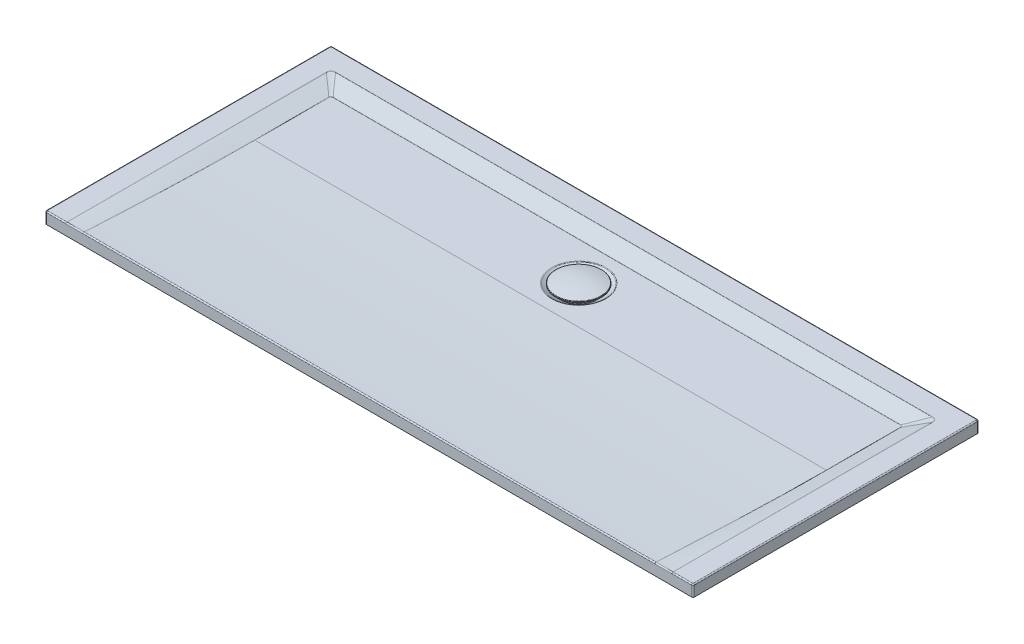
SolidWorks part; units mm, degrees
ref_plane "Płaszczyzna przednia" through (0, 0, 0) normal (0, 0, 1) x (1, 0, 0)
ref_plane "Płaszczyzna górna" through (0, 0, 0) normal (0, 1, 0) x (1, 0, 0)
ref_plane "Płaszczyzna prawa" through (0, 0, 0) normal (1, 0, 0) x (0, 0, -1)
sketch "Szkic1" plane through (0, 0, 0) normal (0, 1, 0) x (1, 0, 0)
  line L0 (0, 375) -> (0, -375) construction
  line L1 (-850, 375) -> (850, 375)
  line L2 (-850, 375) -> (-850, -375)
  line L3 (-850, -375) -> (850, -375)
  line L4 (850, 375) -> (850, -375)
  line L5 (-795, -375) -> (-795, 320)
  line L6 (-795, 320) -> (795, 320)
  line L7 (795, 320) -> (795, -375)
  line L8 (-750, -375) -> (-750, 275)
  line L9 (-750, 275) -> (750, 275)
  line L10 (750, 275) -> (750, -375)
  circle A0 centre (0, 175) radius 45
  circle A1 centre (0, 175) radius 70
  point P9 (0, 320)
  dimension "D6" = 90
  dimension "D7" = 140
  dimension "D1" = 1700
  dimension "D2" = 55
  dimension "D3" = 55
  dimension "D5" = 200
  dimension "D8" = 750
  dimension "D4" = 45
sketch "Szkic2" plane through (0, 0, 0) normal (0, 1, 0) x (1, 0, 0)
  line L0 (-850, -375) -> (850, -375) construction
  line L1 (850, 375) -> (850, -375) construction
  line L2 (795, 320) -> (795, -375) construction
  line L3 (-795, 320) -> (795, 320) construction
  line L4 (-850, 375) -> (850, 375) construction
  line L5 (-795, -375) -> (-795, 320) construction
  line L6 (-850, 375) -> (-850, -375) construction
  line L7 (-850, -375) -> (-795, -375)
  line L8 (850, 375) -> (850, -375)
  line L9 (795, 320) -> (795, -375)
  line L10 (-795, 320) -> (795, 320)
  line L11 (-850, 375) -> (850, 375)
  line L12 (-795, -375) -> (-795, 320)
  line L13 (-850, 375) -> (-850, -375)
  line L14 (795, -375) -> (850, -375)
surface "Powierzchnia-Płaszczyzna1" sketch "Szkic2"
ref_plane "Płaszczyzna1" through (0, -15, 0) normal (0, 1, 0) x (-1, 0, 0)
sketch "Szkic3" plane through (0, -15, 0) normal (0, 1, 0) x (-1, 0, 0)
  line L0 (750, -75) -> (-750, -75)
  line L1 (750, 375) -> (750, -275) construction
  line L2 (-750, -275) -> (-750, 375) construction
  line L3 (0, -75) -> (0, -275) construction
  line L4 (750, -275) -> (-750, -275) construction
  line L5 (-750, -275) -> (-750, -75)
  line L6 (750, -75) -> (750, -275)
  line L7 (750, -275) -> (-750, -275)
  circle A0 centre (0, -175) radius 70 construction
  circle A1 centre (0, -175) radius 70
  point P10 (0, -175)
surface "Powierzchnia-Płaszczyzna2" sketch "Szkic3"
sketch "Szkic4" plane through (0, 0, 0) normal (0, 1, 0) x (1, 0, 0)
  line L0 (750, -375) -> (-750, -375)
other "Granica-Powierzchnia1"
other "Granica-Powierzchnia2"
other "Granica-Powierzchnia3"
mirror "Lustro1" about plane through (0, 0, 0) normal (1, 0, 0)
sketch "Szkic5" plane through (0, 0, 0) normal (0, 1, 0) x (1, 0, 0)
  line L0 (850, 375) -> (850, -375) construction
  line L1 (-850, 375) -> (850, 375) construction
  line L2 (-850, 375) -> (-850, -375) construction
  line L3 (-850, -375) -> (850, -375) construction
  line L4 (850, 375) -> (850, -375)
  line L5 (-850, 375) -> (850, 375)
  line L6 (-850, 375) -> (-850, -375)
  line L7 (-850, -375) -> (850, -375)
surface "Powierzchnia-Wyciągnięcie1" sketch "Szkic5" parameters "D1"=30
sketch "Szkic7" plane through (0, 0, 0) normal (1, 0, 0) x (0, 0, -1)
  line L0 (175, 0) -> (175, -30) construction
  line L1 (375, -30) -> (-375, -30) construction
  line L2 (220, -30) -> (220, -28)
  line L3 (220, -28) -> (224, -28)
  line L6 (224, -28) -> (245, -15)
  dimension "D1" = 90
  dimension "D2" = 2
  dimension "D3" = 98
surface "Powierzchnia-Obrót wokół linii środkowej1" sketch "Szkic7" parameters "D1"=360
surface "Powierzchnia-Płaszczyzna3"
surface "Powierzchnia-Połącz1"
fillet "Zaokrąglenie1" radius 4 6 edges at (0, -28, -224) (0, -15, -105) (850, -15, 375) (850, -15, -375) (-850, -15, -375) (-850, -15, 375)
fillet "Zmienne zaokrąglenie1" radius 40 2 edges at (772.5, -7.5, -297.5)
fillet "Zaokrąglenie3" radius 3 12 edges
fillet "Zaokrąglenie4" radius 3 12 edges at (-848.8284, 0, -373.8284) (0, 0, -375) (848.8284, 0, -373.8284) (850, 0, 0) (848.8284, 0, 373.8284) (820.5, 0, 375) (-820.5, 0, 375) (-848.8284, 0, 373.8284) (-850, 0, 0)
sketch "Szkic8" plane through (0, 0, 0) normal (1, 0, 0) x (0, 0, -1)
  line L0 (175, 0) -> (175, -30) construction
  line L1 (175, -5.6601) -> (179.8469, -5.6601) construction
  line L2 (235, -14.7573) -> (235, -17)
  line L3 (235, -17) -> (175, -17)
  line L4 (175, -17) -> (175, -5.6601)
  line L5 (175, -5.6601) -> (199.9922, 95.6514)
  arc A0 (175, -5.6601) -> (234.2694, -13.7943) centre (175, -225.6601) cw
  arc A1 (234.2694, -13.7943) -> (235, -14.7573) centre (234, -14.7573) cw
  point P11 (235, -14)
  dimension "D1" = 220
  dimension "D4" = 1
  dimension "D2" = 60
  dimension "D3" = 3
  dimension "D5" = 13
revolve "Obrót wokół linii środkowej1" add sketch "Szkic8" angle 360 about L4
